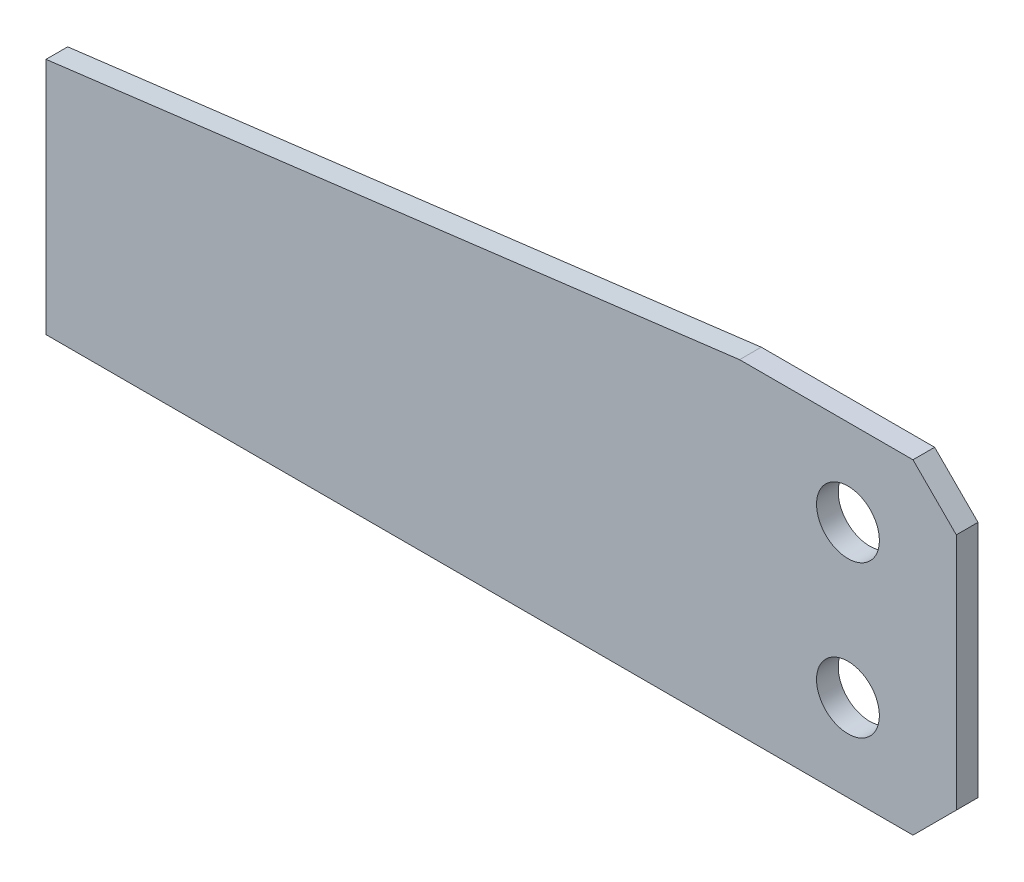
SolidWorks part; units mm, degrees
ref_plane "Face" through (0, 0, 0) normal (0, 0, 1) x (1, 0, 0)
ref_plane "Dessus" through (0, 0, 0) normal (0, 1, 0) x (1, 0, 0)
ref_plane "Droite" through (0, 0, 0) normal (1, 0, 0) x (0, 0, -1)
sketch "Esquisse1" plane through (0, 0, 0) normal (0, 0, 1) x (1, 0, 0)
  line L0 (-100, 0) -> (-420, -40)
  line L1 (-20, 0) -> (-100, 0)
  line L2 (0, -20) -> (0, -130)
  line L3 (-20, -150) -> (-420, -150)
  line L4 (-420, -40) -> (-420, -150)
  line L5 (0, -20) -> (-20, 0)
  line L6 (0, -130) -> (-20, -150)
  circle A0 centre (-50, -40) radius 14.5
  circle A1 centre (-50, -110) radius 14.5
  point P0 (0, 0)
  point P2 (0, -150)
  dimension "D8" = 29
  dimension "D1" = 420
  dimension "D2" = 150
  dimension "D3" = 110
  dimension "D4" = 100
  dimension "D5" = 370
  dimension "D6" = 40
  dimension "D7" = 110
  dimension "D9" = 20
  dimension "D10" = 45
  dimension "D11" = 20
  dimension "D12" = 45
extrude "Base-Extrusion" add sketch "Esquisse1" along normal blind 10
